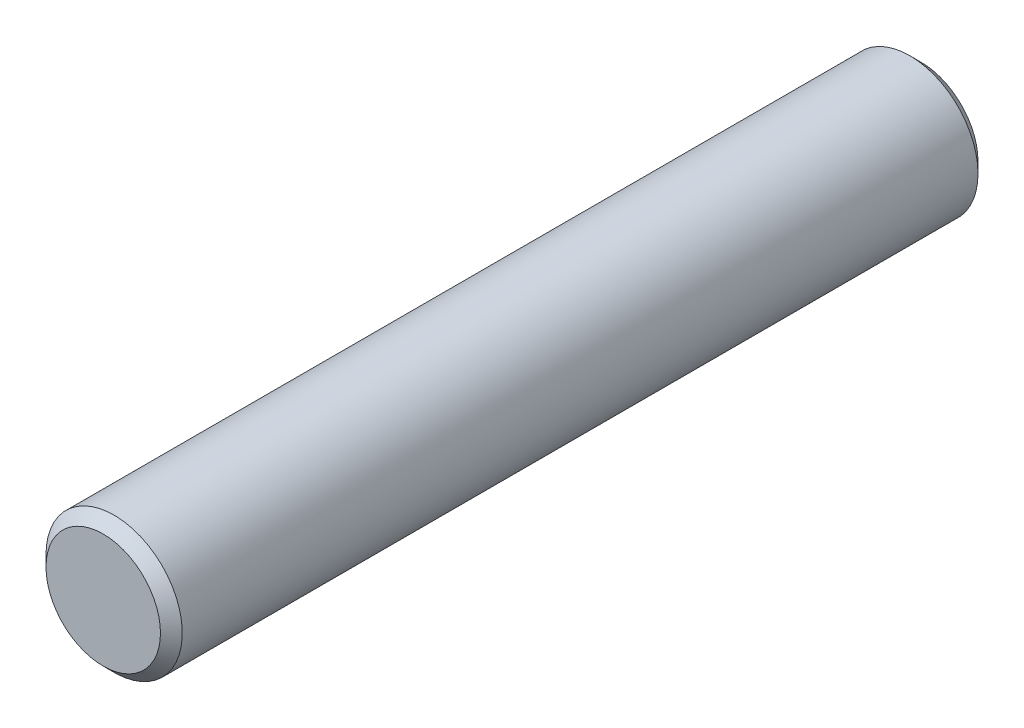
SolidWorks part; units mm, degrees
ref_plane "Front Plane" through (0, 0, 0) normal (0, 0, 1) x (1, 0, 0)
ref_plane "Top Plane" through (0, 0, 0) normal (0, 1, 0) x (1, 0, 0)
ref_plane "Right Plane" through (0, 0, 0) normal (1, 0, 0) x (0, 0, -1)
sketch "Sketch1" plane through (0, 0, 0) normal (0, 0, 1) x (1, 0, 0)
  circle A0 centre (0, 0) radius 0.7937
  dimension "D1" = 1.5875
extrude "Extrude1" add sketch "Sketch1" along normal blind 9.525
chamfer "Chamfer1" distance 0.127 angle 45 2 edges at (0.7937, 0, 9.525) (0.7937, 0, 0)
